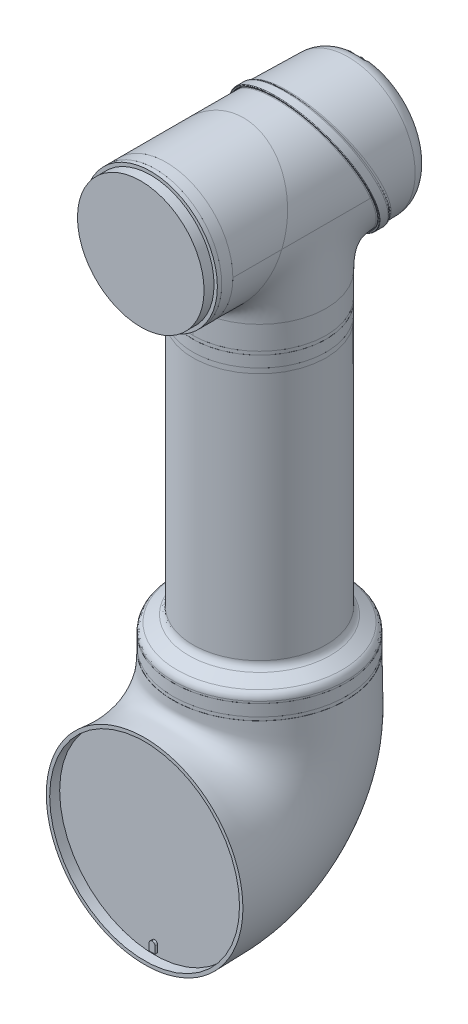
SolidWorks part; units mm, degrees
ref_plane "前视基准面" through (0, 0, 0) normal (0, 0, 1) x (1, 0, 0)
ref_plane "上视基准面" through (0, 0, 0) normal (0, 1, 0) x (1, 0, 0)
ref_plane "右视基准面" through (0, 0, 0) normal (1, 0, 0) x (0, 0, -1)
imported_body "GBT-C5A-300.01-0200_defeature-1-solid1"
imported_body "GBT-C5A-300.02-0301_defeature-1-solid1"
imported_body "GBT-SIZE1.01-T-0200_defeature-1-solid1"
imported_body "GBT-SIZE1.01-T-0200_defeature-1-solid2"
imported_body "GBT-SIZE1.01-T-0200_defeature-1-solid3"
imported_body "SIZE1关节后盖组件-1-solid1"
sketch "草图1" plane through (0, 0, 0) normal (1, 0, 0) x (0, 0, -1)
  line L0 (69, 64) -> (69, 457.5677) construction
  line L1 (19, 64) -> (119, 64) construction
  line L2 (29, 325) -> (109, 325) construction
  line L3 (29, 325) -> (31, 325)
  line L4 (29, 325) -> (29, 318.3)
  line L5 (29, 318.3) -> (31, 318.3)
  line L6 (31, 325) -> (31, 318.3)
  line L7 (109, 318.3) -> (29, 318.3) construction
  line L8 (19, 79) -> (119, 79) construction
  line L9 (17, 79) -> (19, 79)
  line L10 (17, 79) -> (17, 72)
  line L11 (17, 72) -> (19, 72)
  line L12 (19, 79) -> (19, 72)
  line L13 (17, 79) -> (121, 79) construction
  line L14 (121, 72) -> (17, 72) construction
  dimension "D1" = 76
  dimension "D2" = 2
  dimension "D3" = 100
  dimension "D4" = 2
revolve "旋转1" add sketch "草图1" angle 360 about L0
ref_plane "基准面1" through (0, 92.815, 0) normal (0, 1, 0) x (1, 0, 0)
ref_plane "基准面2" through (0, 166.115, 0) normal (0, 1, 0) x (1, 0, 0)
split "分割1" trim tools "基准面1", "基准面2" bodies to split 107 resulting bodies 114 115
move or copy body "实体-移动/复制1" bodies to move or copy 109 114 111 112 108 110 placed by mates yes
combine bodies "组合1" operation type add bodies to combine 117 115
